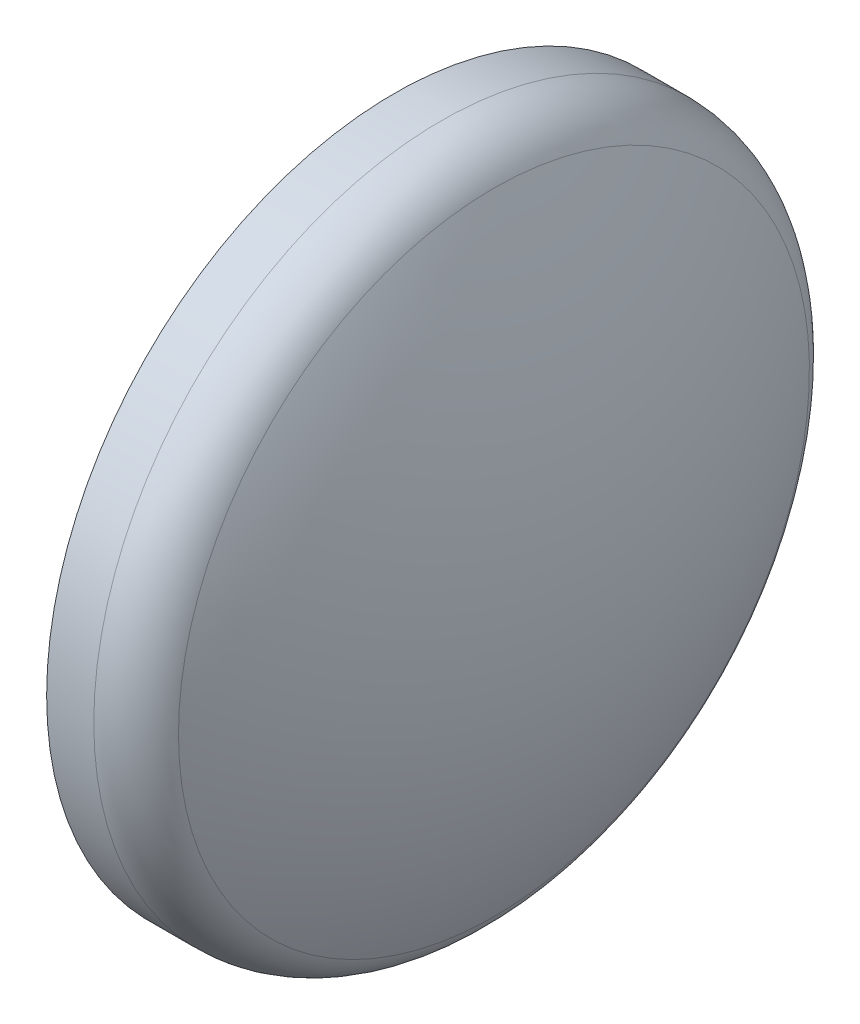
SolidWorks part; units mm, degrees
ref_plane "Plan de face" through (0, 0, 0) normal (0, 0, 1) x (1, 0, 0)
ref_plane "Plan de dessus" through (0, 0, 0) normal (0, 1, 0) x (1, 0, 0)
ref_plane "Plan de droite" through (0, 0, 0) normal (1, 0, 0) x (0, 0, -1)
sketch "Esquisse1" plane through (0, 0, 0) normal (0, 0, 1) x (1, 0, 0)
  line L0 (698.7776, 0) -> (550, 0)
  line L1 (57.1901, 0) -> (1266.8834, 0) construction
  line L2 (550, 295) -> (590, 295)
  line L3 (550, 0) -> (550, 295)
  line L6 (550, -295) -> (550, 295) construction
  arc A2 (698.7776, 0) -> (634.5576, 267.6852) centre (108.7776, 0) ccw
  arc A3 (590, 295) -> (634.5576, 267.6852) centre (590, 245) cw
revolve "Révolution3" add sketch "Esquisse1" angle 360 about L1
